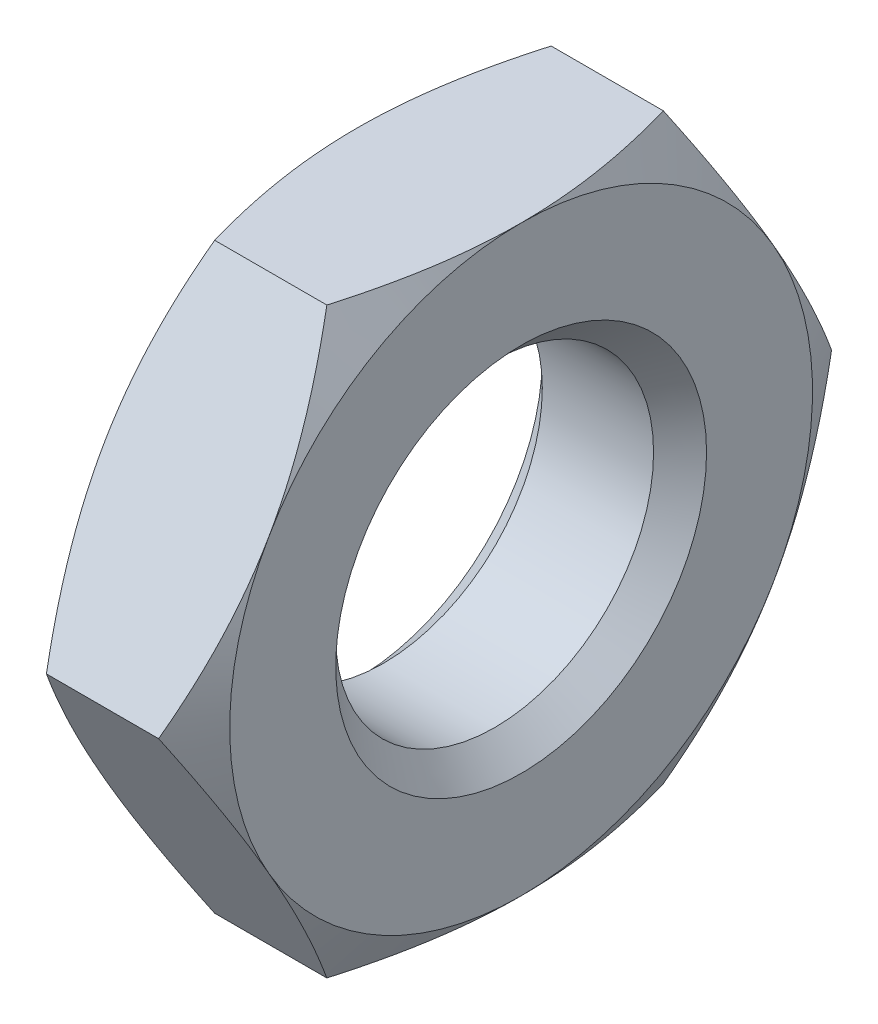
SolidWorks part; units mm, degrees
ref_plane "Front Plane" through (0, 0, 0) normal (0, 0, 1) x (1, 0, 0)
ref_plane "Top Plane" through (0, 0, 0) normal (0, 1, 0) x (1, 0, 0)
ref_plane "Right Plane" through (0, 0, 0) normal (1, 0, 0) x (0, 0, -1)
sketch "Sketch1" plane through (0, 0, 0) normal (1, 0, 0) x (0, 0, -1)
  line L1 (1.5877, 2.75) -> (-1.5877, 2.75)
  line L2 (-1.5877, 2.75) -> (-3.1754, 0)
  line L3 (-3.1754, 0) -> (-1.5877, -2.75)
  line L4 (-1.5877, -2.75) -> (1.5877, -2.75)
  line L5 (1.5877, -2.75) -> (3.1754, 0)
  line L6 (3.1754, 0) -> (1.5877, 2.75)
  circle A0 centre (0, 0) radius 2.75 construction
  circle A1 centre (0, 0) radius 1.5
extrude "Extrude1" add sketch "Sketch1" along normal blind 1.55
sketch "Sketch2" plane through (0, 0, 0) normal (0, 0, 1) x (1, 0, 0)
  line L0 (1.55, 2.75) -> (1.55, 11)
  line L1 (1.55, 11) -> (0, 11)
  line L2 (0, 11) -> (0, 2.75)
  line L3 (0, 2.75) -> (0.775, 4.0923)
  line L4 (0.775, 4.0923) -> (1.55, 2.75)
revolve "Cut-Revolve1" cut sketch "Sketch2" angle 360 about axis through (1.55, 0, 0) along (-1, 0, 0)
chamfer "Chamfer1" distance 0.25 angle 45 2 edges at (0, 0, -1.5) (1.55, 0, -1.5)
equation "\"D2@Sketch2\"=\"D1@Sketch1\"*2"
